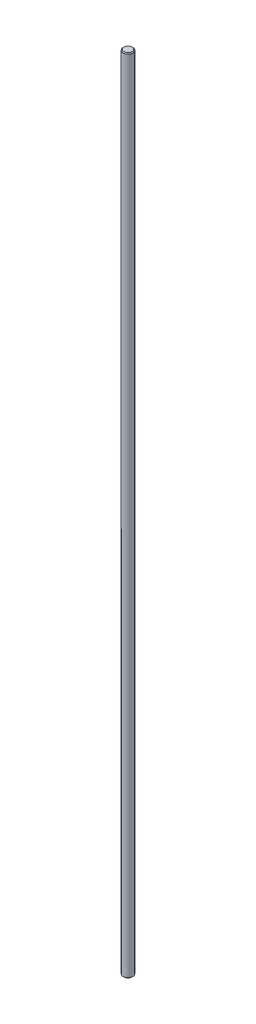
SolidWorks part; units mm, degrees
ref_plane "Plan de face" through (0, 0, 0) normal (0, 0, 1) x (1, 0, 0)
ref_plane "Plan de dessus" through (0, 0, 0) normal (0, 1, 0) x (1, 0, 0)
ref_plane "Plan de droite" through (0, 0, 0) normal (1, 0, 0) x (0, 0, -1)
sketch "Esquisse1" plane through (0, 0, 0) normal (0, 1, 0) x (1, 0, 0)
  circle A0 centre (0, 0) radius 3
extrude "Extrusion1" add sketch "Esquisse1" along normal blind 500
chamfer "Chanfrein1" distance 0.5 angle 45 2 edges at (0, 0, 3) (0, 500, 3)
